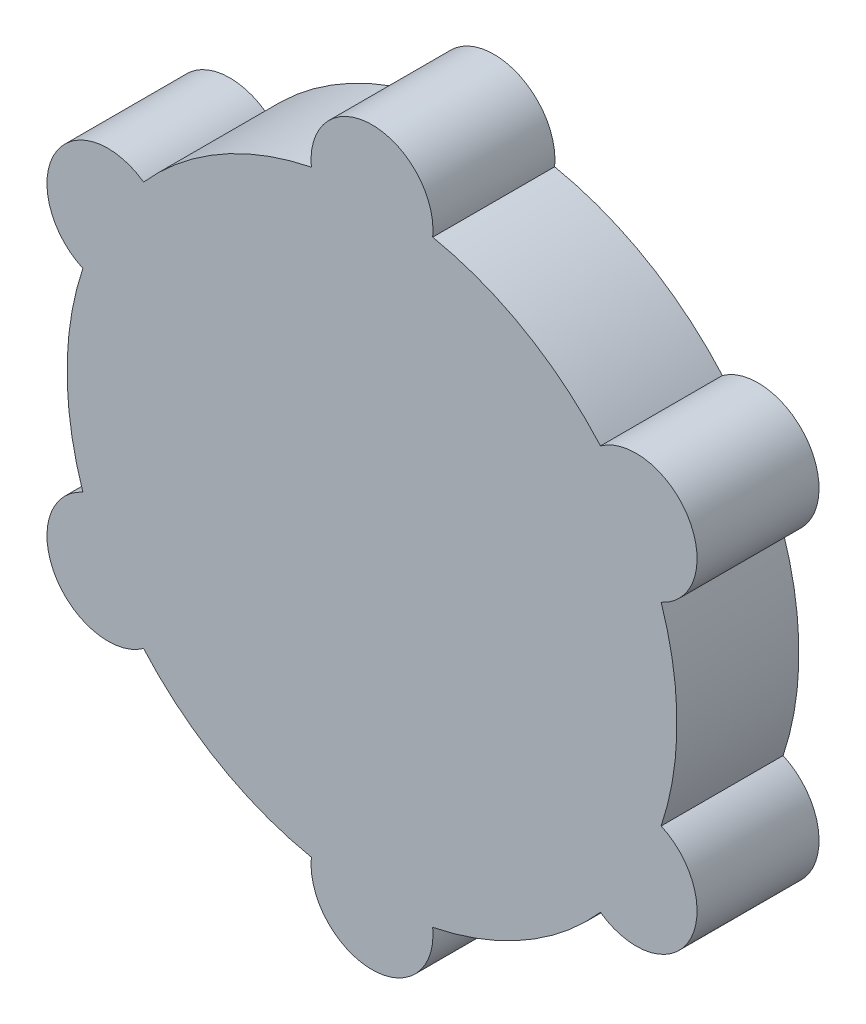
SolidWorks part; units mm, degrees
ref_plane "Plane1" through (0, 0, 0) normal (0, 0, 1) x (1, 0, 0)
ref_plane "Plane2" through (0, 0, 0) normal (0, 1, 0) x (1, 0, 0)
ref_plane "Plane3" through (0, 0, 0) normal (1, 0, 0) x (0, 0, -1)
sketch "Sketch1" plane through (0, 0, 0) normal (0, 0, 1) x (0.866, 0.5, 0)
  arc A0 (49, 9.9499) -> (33.1168, 37.4603) centre (0, 0) ccw
  arc A1 (49, -9.9499) -> (49, 9.9499) centre (50, 0) ccw
  arc A2 (15.8832, -47.4102) -> (33.1168, -37.4603) centre (25, -43.3013) ccw
  arc A3 (-33.1168, -37.4603) -> (-15.8832, -47.4102) centre (-25, -43.3013) ccw
  arc A4 (-49, 9.9499) -> (-49, -9.9499) centre (-50, 0) ccw
  arc A5 (-15.8832, 47.4102) -> (-33.1168, 37.4603) centre (-25, 43.3013) ccw
  arc A6 (33.1168, 37.4603) -> (15.8832, 47.4102) centre (25, 43.3013) ccw
  arc A7 (15.8832, 47.4102) -> (-15.8832, 47.4102) centre (0, 0) ccw
  arc A8 (-33.1168, 37.4603) -> (-49, 9.9499) centre (0, 0) ccw
  arc A9 (-49, -9.9499) -> (-33.1168, -37.4603) centre (0, 0) ccw
  arc A10 (-15.8832, -47.4102) -> (15.8832, -47.4102) centre (0, 0) ccw
  arc A11 (33.1168, -37.4603) -> (49, -9.9499) centre (0, 0) ccw
  arc A12 (25.9808, 15) -> (0, 30) centre (0, 0) ccw construction
  arc A13 (34.641, 20) -> (0, 40) centre (0, 0) ccw construction
  arc A14 (0, 40) -> (0, 30) centre (0, 35) ccw construction
  arc A15 (25.9808, 15) -> (34.641, 20) centre (30.3109, 17.5) ccw construction
  dimension "D1" = 100
  dimension "D4" = 10
  dimension "D5" = 30
  dimension "D6" = 30
  dimension "D8" = 10
  dimension "D7" = 60
extrude "Base-Extrude" add sketch "Sketch1" along normal blind 20
sketch "Sketch2" plane through (0, 0, 20) normal (0, 0, 1) x (1, 0, 0)
  arc A0 (-20, 34.641) -> (-15, 25.9808) centre (-17.5, 30.3109) ccw construction
  arc A1 (20, 34.641) -> (-20, 34.641) centre (0, 0) ccw construction
  arc A2 (15, 25.9808) -> (20, 34.641) centre (17.5, 30.3109) ccw construction
  arc A3 (15, 25.9808) -> (-15, 25.9808) centre (0, 0) ccw construction
  arc A4 (-20, 34.641) -> (-15, 25.9808) centre (-17.5, 30.3109) ccw
  arc A5 (20, 34.641) -> (-20, 34.641) centre (0, 0) ccw
  arc A6 (15, 25.9808) -> (20, 34.641) centre (17.5, 30.3109) ccw
  arc A7 (15, 25.9808) -> (-15, 25.9808) centre (0, 0) ccw
